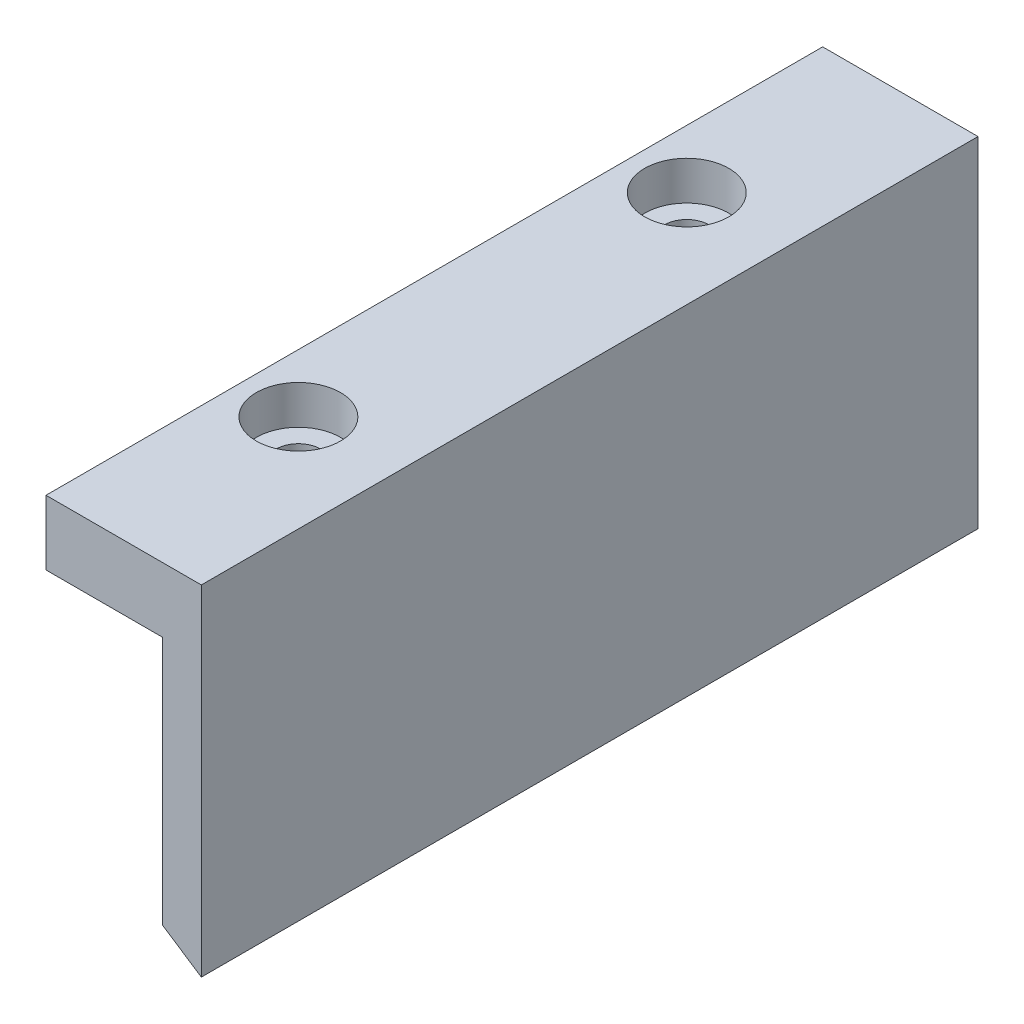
SolidWorks part; units mm, degrees
ref_plane "Front Plane" through (0, 0, 0) normal (0, 0, 1) x (1, 0, 0)
ref_plane "Top Plane" through (0, 0, 0) normal (0, 1, 0) x (1, 0, 0)
ref_plane "Right Plane" through (0, 0, 0) normal (1, 0, 0) x (0, 0, -1)
sketch "Sketch2" plane through (0, 0, 0) normal (0, 0, 1) x (1, 0, 0)
  line L0 (85.25, 15) -> (85.25, 45.2)
  line L1 (70.25, 60.2) -> (0, 60.2)
  line L2 (0, 60.2) -> (0, 33.96)
  line L3 (0, 33.96) -> (-3, 35.94)
  line L4 (-3, 35.94) -> (-3, 24.26)
  line L5 (-3, 24.26) -> (0, 26.24)
  line L6 (0, 26.24) -> (0, 0)
  line L7 (0, 0) -> (70.25, 0)
  line L8 (30, 41.37) -> (30, 11.37)
  line L9 (40, 1.37) -> (70, 1.37)
  line L10 (80, 11.37) -> (80, 41.37)
  line L11 (70, 51.37) -> (40, 51.37)
  arc A0 (70.25, 0) -> (85.25, 15) centre (70.25, 15) ccw
  arc A1 (85.25, 45.2) -> (70.25, 60.2) centre (70.25, 45.2) ccw
  arc A2 (30, 11.37) -> (40, 1.37) centre (40, 11.37) ccw
  arc A3 (70, 1.37) -> (80, 11.37) centre (70, 11.37) ccw
  arc A4 (80, 41.37) -> (70, 51.37) centre (70, 41.37) ccw
  arc A5 (40, 51.37) -> (30, 41.37) centre (40, 41.37) ccw
  point P24 (0, 0)
  dimension "D3" = 15
  dimension "D7" = 10
  dimension "D1" = 85.25
  dimension "D2" = 60.2
  dimension "D4" = 3
  dimension "D5" = 11.68
  dimension "D6" = 7.72
  dimension "D8" = 50
  dimension "D9" = 50
  dimension "D10" = 5.25
  dimension "D11" = 1.37
sketch "Sketch3" plane through (0, 0, 0) normal (0, 0, 1) x (1, 0, 0)
  line L0 (0, 60.2) -> (0, 33.96) construction
  line L1 (0, 33.96) -> (-3, 35.94) construction
  line L2 (0, 60.2) -> (0, 33.96)
  line L3 (0, 33.96) -> (-3, 35.94)
  line L4 (0, 60.2) -> (-12, 60.2)
  line L5 (-12, 60.2) -> (-12, 55.2)
  line L6 (-12, 55.2) -> (-3, 55.2)
  line L7 (-3, 55.2) -> (-3, 35.94)
  point P2 (0, 0)
  point P8 (-3, 58.0713)
  point P10 (0, 62.547)
  dimension "D1" = 12
  dimension "D2" = 5
extrude "Boss-Extrude1" add sketch "Sketch3" along normal blind 60
hole_wizard "CBORE for M3 SHCS1" positions "Sketch4" profile "Sketch5" counterbore size "M3" standard "ANSI Metric"
sketch "Sketch4" plane through (0, 60.2, 0) normal (0, 1, 0) x (1, 0, 0)
  line L0 (-7.5, -15) -> (-7.5, -45) construction
  line L2 (0, 0) -> (-12, 0) construction
  line L3 (0, -60) -> (0, 0) construction
  line L4 (-12, -60) -> (-3, -60) construction
  point P0 (-7.5, -15)
  point P2 (-7.5, -45)
  point P12 (-6, 0)
  point P16 (0, -30)
  point P17 (-7.5, -30)
  point P20 (-7.5, -60)
  dimension "D1" = 30
sketch "Sketch5" plane through (-7.5, 60.2, 15) normal (1, 0, 0) x (0, 0, 1)
  line L0 (0, 0) -> (0, 6.0215)
  line L1 (0, 6.0215) -> (1.7, 5)
  line L2 (1.7, 5) -> (1.7, 3)
  line L3 (1.7, 3) -> (3.25, 3)
  line L4 (3.25, 3) -> (3.25, 0)
  line L5 (3.25, 0) -> (0, 0)
  line L10 (0, 6.0215) -> (-1.7, 5) construction
  line L11 (0, -6.35) -> (0, 107.95) construction
  dimension "Hole Dia." = 3.4
  dimension "Hole Depth" = 5
  dimension "C'Bore Dia." = 6.5
  dimension "C'Bore Depth" = 3
  dimension "Drill Angle" = 118
